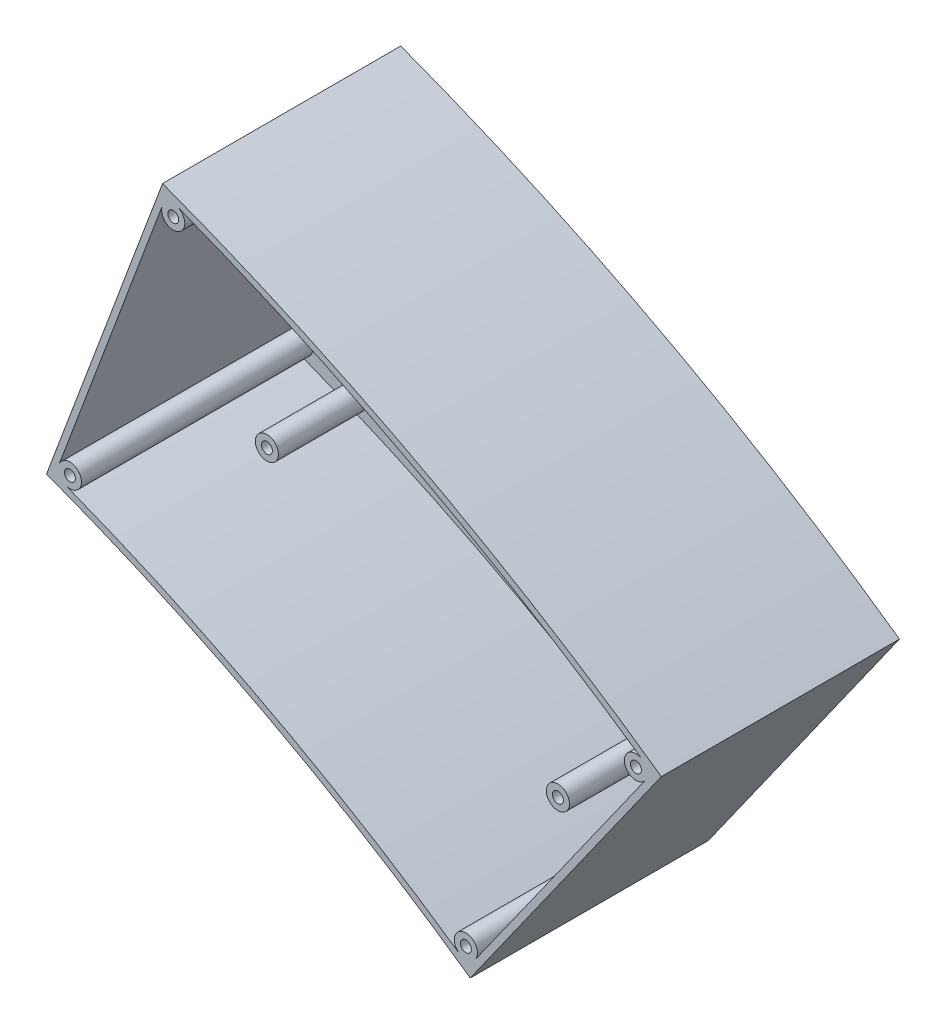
SolidWorks part; units mm, degrees
ref_plane "Front Plane" through (0, 0, 0) normal (0, 0, 1) x (1, 0, 0)
ref_plane "Top Plane" through (0, 0, 0) normal (0, 1, 0) x (1, 0, 0)
ref_plane "Right Plane" through (0, 0, 0) normal (1, 0, 0) x (0, 0, -1)
sketch "Sketch2" plane through (0, 0, 0) normal (0, 0, 1) x (1, 0, 0)
  line L0 (0, 0) -> (198.2974, 529.0587) construction
  line L1 (0, 0) -> (326.4209, 461.1664) construction
  line L2 (198.2974, 529.0587) -> (233.3943, 622.6975)
  line L3 (326.4209, 461.1664) -> (384.1945, 542.7887)
  arc A1 (326.4209, 461.1664) -> (198.2974, 529.0587) centre (0, 0) ccw
  arc A2 (384.1945, 542.7887) -> (233.3943, 622.6975) centre (0, 0) ccw
  dimension "D1" = 1330
  dimension "D2" = 100
  dimension "D3" = 145
extrude "Boss-Extrude1" add sketch "Sketch2" against normal blind 2
sketch "Sketch4" plane through (0, 0, 0) normal (0, 0, 1) x (1, 0, 0)
  line L0 (233.3943, 622.6975) -> (198.2974, 529.0587)
  line L1 (326.4209, 461.1664) -> (384.1945, 542.7887)
  arc A0 (198.2974, 529.0587) -> (326.4209, 461.1664) centre (0, 0) cw
  arc A1 (384.1945, 542.7887) -> (233.3943, 622.6975) centre (0, 0) ccw
extrude "Extrude-Thin1" add sketch "Sketch4" along normal blind 70 thin
sketch "Sketch5" plane through (0, 0, 0) normal (0, 0, 1) x (1, 0, 0)
  circle A0 centre (234.931, 539.2594) radius 3.5
  circle A1 centre (258.6936, 583.2519) radius 3.5
  arc A2 (325.9418, 463.9514) -> (200.8708, 530.2263) centre (0, 0) ccw construction
  arc A3 (381.4048, 542.3093) -> (234.564, 620.1199) centre (0, 0) ccw construction
  arc A4 (325.9418, 463.9514) -> (200.8708, 530.2263) centre (0, 0) ccw construction
  arc A5 (381.4048, 542.3093) -> (234.564, 620.1199) centre (0, 0) ccw construction
  circle A6 centre (346.6786, 535.7267) radius 3.5
  circle A7 centre (322.916, 491.7342) radius 3.5
  point P2 (308.0388, 476.0264)
  point P5 (358.1586, 557.9349)
  point P6 (217.4938, 523.6272)
  point P17 (270.2509, 605.42)
  dimension "D3" = 25
extrude "Boss-Extrude2" add sketch "Sketch5" along normal blind 40
sketch "Sketch6" plane through (0, 0, 40) normal (0, 0, 1) x (1, 0, 0)
  circle A0 centre (346.6786, 535.7267) radius 1.65
  circle A2 centre (322.916, 491.7342) radius 1.65
  circle A3 centre (234.931, 539.2594) radius 1.65
  circle A4 centre (258.6936, 583.2519) radius 1.65
extrude "Cut-Extrude1" cut sketch "Sketch6" against normal blind 20
sketch "Sketch8" plane through (0, 0, 0) normal (0, 0, 1) x (1, 0, 0)
  line L0 (325.9418, 463.9514) -> (381.4048, 542.3093) construction
  line L1 (381.4048, 542.3093) -> (379.3712, 539.4363)
  line L3 (234.564, 620.1199) -> (233.3287, 616.8239)
  line L4 (202.0912, 533.4821) -> (200.8708, 530.2263)
  line L5 (327.9506, 466.7894) -> (325.9418, 463.9514)
  arc A0 (378.5126, 544.3319) -> (379.3712, 539.4363) centre (376.5144, 541.4583) ccw
  arc A1 (233.3287, 616.8239) -> (237.8617, 618.8625) centre (236.606, 615.5955) ccw
  arc A2 (325.9418, 463.9514) -> (200.8708, 530.2263) centre (0, 0) ccw construction
  arc A4 (381.4048, 542.3093) -> (234.564, 620.1199) centre (0, 0) ccw construction
  arc A5 (204.1086, 528.9884) -> (202.0912, 533.4821) centre (205.3685, 532.2537) ccw
  arc A6 (327.9506, 466.7894) -> (323.0994, 465.9354) centre (325.0939, 468.8115) ccw
  arc A7 (237.8617, 618.8625) -> (234.564, 620.1199) centre (0, 0) ccw
  arc A8 (381.4048, 542.3093) -> (378.5126, 544.3319) centre (0, 0) ccw
  arc A10 (325.9418, 463.9514) -> (323.0994, 465.9354) centre (0, 0) ccw
  arc A11 (204.1086, 528.9884) -> (200.8708, 530.2263) centre (0, 0) ccw
extrude "Boss-Extrude15" add sketch "Sketch8" along normal blind 70
sketch "Sketch9" plane through (0, 0, 70) normal (0, 0, 1) x (1, 0, 0)
  circle A0 centre (236.606, 615.5955) radius 1.65
  circle A1 centre (376.5144, 541.4583) radius 1.65
  circle A2 centre (205.3685, 532.2537) radius 1.65
  circle A3 centre (325.0939, 468.8115) radius 1.65
extrude "Cut-Extrude2" cut sketch "Sketch9" against normal blind 20
sketch "Sketch10" plane through (0, 0, 0) normal (0, 0, 1) x (1, 0, 0)
  line L0 (233.3287, 616.8239) -> (202.0912, 533.4821) construction
  line L1 (327.9506, 466.7894) -> (379.3712, 539.4363) construction
  circle A0 centre (326.2443, 507.6511) radius 3.2
  circle A1 centre (237.4425, 556.5683) radius 3.2
  dimension "D1" = 6.4
  dimension "D2" = 6.4
  dimension "D3" = 25
  dimension "D4" = 25
extrude "Cut-Extrude3" cut sketch "Sketch10" against normal blind 20
sketch "Sketch11" plane through (0, 0, 0) normal (0, 0, 1) x (1, 0, 0)
  line L1 (303.8338, 553.4114) -> (283.8338, 553.4114)
  line L2 (303.8338, 553.4114) -> (303.8338, 533.4114)
  line L3 (303.8338, 533.4114) -> (283.8338, 533.4114)
  line L4 (283.8338, 553.4114) -> (283.8338, 533.4114)
  dimension "D1" = 20
  dimension "D2" = 20
  dimension "D3" = 20
extrude "Cut-Extrude4" cut sketch "Sketch11" against normal blind 20
